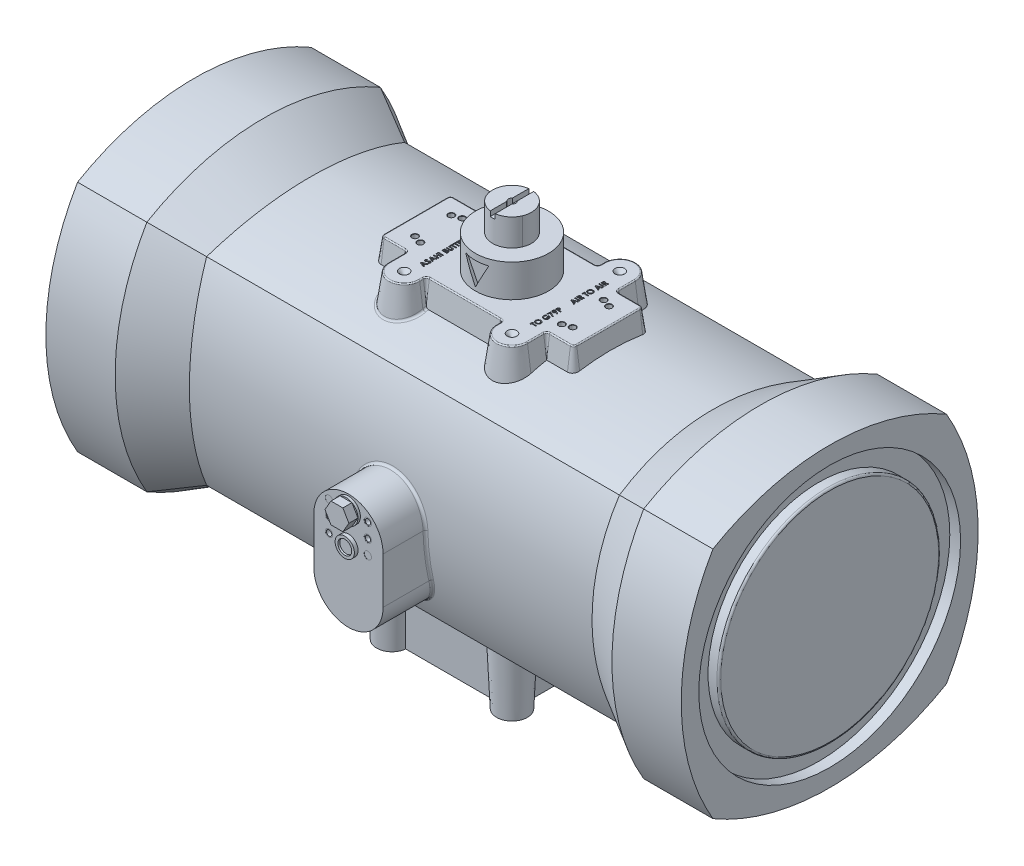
SolidWorks part; units mm, degrees
ref_plane "Front" through (0, 0, 0) normal (0, 0, 1) x (1, 0, 0)
ref_plane "Top" through (0, 0, 0) normal (0, 1, 0) x (1, 0, 0)
ref_plane "Right" through (0, 0, 0) normal (1, 0, 0) x (0, 0, -1)
sketch "Sketch1" plane through (0, 0, 0) normal (1, 0, 0) x (0, 0, -1)
  line L0 (0, 0) -> (-111.6723, 0) construction
  line L1 (0, 0) -> (0, 113.5403) construction
  circle A0 centre (0, 0) radius 72.39 construction
  circle A1 centre (0, 0) radius 100.0125 construction
  arc A2 (81.6346, 81.6346) -> (-81.6346, 81.6346) centre (0, -90.4875) ccw
  arc A3 (81.6346, -81.6346) -> (-81.6346, -81.6346) centre (0, 90.4875) cw
  arc A4 (-81.6346, 81.6346) -> (-81.6346, -81.6346) centre (90.4875, 0) ccw
  arc A5 (81.6346, 81.6346) -> (81.6346, -81.6346) centre (-90.4875, 0) cw
  dimension "D1" = 144.78
  dimension "D2" = 200.025
  dimension "D3" = 381
  dimension "D4" = 381
extrude "BODY DIA" add sketch "Sketch1" along normal mid plane 524.002
sketch "Sketch2" plane through (262.001, 0, 0) normal (1, 0, 0) x (0, 0, -1)
  line L0 (0, 0) -> (0, 112.2833) construction
  line L1 (0, 0) -> (-109.8095, 0) construction
  arc A0 (96.2969, 96.2969) -> (-96.2969, 96.2969) centre (0, -68.072) ccw
  arc A1 (96.2969, -96.2969) -> (-96.2969, -96.2969) centre (0, 68.072) cw
  arc A2 (-96.2969, 96.2969) -> (-96.2969, -96.2969) centre (68.072, 0) ccw
  arc A3 (96.2969, 96.2969) -> (96.2969, -96.2969) centre (-68.072, 0) cw
  circle A4 centre (0, 0) radius 122.428 construction
  dimension "D3" = 244.856
  dimension "D1" = 381
  dimension "D2" = 381
extrude "END1" add sketch "Sketch2" against normal blind 57.15
mirror "END2" about plane through (0, 0, 0) normal (1, 0, 0) of "END1"
sketch "Sketch3" plane through (204.851, 0, 0) normal (-1, 0, 0) x (0, 0, 1)
  arc A5 (96.2969, -96.2969) -> (96.2969, 96.2969) centre (-68.072, 0) ccw construction
  arc A6 (-96.2969, -96.2969) -> (96.2969, -96.2969) centre (0, 68.072) ccw construction
  arc A7 (-96.2969, 96.2969) -> (-96.2969, -96.2969) centre (68.072, 0) ccw construction
  arc A8 (96.2969, 96.2969) -> (-96.2969, 96.2969) centre (0, -68.072) ccw construction
  arc A9 (96.2969, -96.2969) -> (96.2969, 96.2969) centre (-68.072, 0) ccw
  arc A10 (-96.2969, -96.2969) -> (96.2969, -96.2969) centre (0, 68.072) ccw
  arc A11 (-96.2969, 96.2969) -> (-96.2969, -96.2969) centre (68.072, 0) ccw
  arc A12 (96.2969, 96.2969) -> (-96.2969, 96.2969) centre (0, -68.072) ccw
extrude "END DRAFT1" add sketch "Sketch3" along normal blind 50.8 draft 30
mirror "END DRAFT2" about plane through (0, 0, 0) normal (1, 0, 0) of "END DRAFT1"
sketch "Sketch4" plane through (262.001, 0, 0) normal (1, 0, 0) x (0, 0, -1)
  circle A0 centre (0, 0) radius 107.95
  circle A1 centre (0, 0) radius 91.44
  dimension "D1" = 16.51
  dimension "D2" = 215.9
extrude "END DIA DETAIL1" cut sketch "Sketch4" against normal blind 8.89
mirror "END DIA DETAIL2" about plane through (0, 0, 0) normal (1, 0, 0) of "END DIA DETAIL1"
ref_plane "Plane1" through (0, -147.32, 0) normal (0, 1, 0) x (-1, 0, 0)
ref_plane "Plane2" through (0, 115.57, 0) normal (0, 1, 0) x (-1, 0, 0)
sketch "Sketch5" plane through (0, -147.32, 0) normal (0, 1, 0) x (-1, 0, 0)
  line L0 (0, 0) -> (0, 75.2294) construction
  line L1 (0, 0) -> (92.8969, 0) construction
  line L2 (-49.4812, 49.4812) -> (0, 0) construction
  line L5 (50.8, 36.8499) -> (50.8, -36.8499)
  line L6 (36.8499, -50.8) -> (-36.8499, -50.8)
  line L7 (-50.8, 36.8499) -> (-50.8, -36.8499)
  line L8 (36.8499, 50.8) -> (-36.8499, 50.8)
  circle A0 centre (0, 0) radius 69.977 construction
  arc A1 (57.8778, 41.0847) -> (41.0847, 57.8778) centre (49.4812, 49.4812) ccw construction
  arc A2 (-57.8778, 41.0847) -> (-41.0847, 57.8778) centre (-49.4812, 49.4812) cw construction
  arc A3 (-57.8778, -41.0847) -> (-41.0847, -57.8778) centre (-49.4812, -49.4812) ccw construction
  arc A4 (57.8778, -41.0847) -> (41.0847, -57.8778) centre (49.4812, -49.4812) cw construction
  arc A5 (-36.8499, 50.8) -> (-50.8, 36.8499) centre (-49.4812, 49.4812) ccw
  arc A6 (50.8, 36.8499) -> (36.8499, 50.8) centre (49.4812, 49.4812) ccw
  arc A7 (36.8499, -50.8) -> (50.8, -36.8499) centre (49.4812, -49.4812) ccw
  arc A8 (-50.8, -36.8499) -> (-36.8499, -50.8) centre (-49.4812, -49.4812) ccw
  dimension "D1" = 139.954
  dimension "D4" = 23.749
  dimension "D5" = 101.6
  dimension "D6" = 101.6
  dimension "D3" = 25.4
  dimension "D2" = 45
extrude "Extrude4" add sketch "Sketch5" along normal up to next draft 2.5
sketch "Sketch6" plane through (0, -147.32, 0) normal (0, -1, 0) x (1, 0, 0)
  circle A0 centre (0, 0) radius 28.575
  circle A1 centre (0, 0) radius 28.321
  dimension "D1" = 57.15
  dimension "D2" = 0.254
extrude "Cut-Extrude2" cut sketch "Sketch6" against normal blind 19.05
sketch "Sketch7" plane through (0, -147.32, 0) normal (0, -1, 0) x (1, 0, 0)
  line L0 (0, 0) -> (0, 14.5007) construction
  line L1 (0, 0) -> (-14.398, 0) construction
  line L2 (-1.0139, 24.49) -> (-7.4699, 18.034)
  line L3 (-16.6001, 18.034) -> (-7.4699, 18.034)
  line L4 (-18.034, 16.6001) -> (-18.034, 7.4699)
  line L5 (-16.6001, -18.034) -> (-7.4699, -18.034)
  line L6 (18.034, 16.6001) -> (18.034, 7.4699)
  line L7 (-24.49, -1.0139) -> (-18.034, -7.4699)
  line L8 (1.0139, -24.49) -> (7.4699, -18.034)
  line L9 (24.49, 1.0139) -> (18.034, 7.4699)
  line L10 (0, 0) -> (-10.2431, 10.2431) construction
  line L11 (0, 0) -> (10.2285, 10.2285) construction
  line L12 (7.4699, -18.034) -> (16.6001, -18.034)
  line L13 (-7.4699, -18.034) -> (-1.0139, -24.49)
  line L14 (-18.034, -7.4699) -> (-18.034, -16.6001)
  line L15 (-18.034, 7.4699) -> (-24.49, 1.0139)
  line L16 (7.4699, 18.034) -> (16.6001, 18.034)
  line L17 (7.4699, 18.034) -> (1.0139, 24.49)
  line L18 (18.034, -7.4699) -> (18.034, -16.6001)
  line L19 (18.034, -7.4699) -> (24.49, -1.0139)
  arc A0 (-24.49, 1.0139) -> (-24.49, -1.0139) centre (0, 0) ccw
  arc A1 (-18.034, -16.6001) -> (-16.6001, -18.034) centre (0, 0) ccw
  arc A2 (-1.0139, -24.49) -> (1.0139, -24.49) centre (0, 0) ccw
  arc A3 (16.6001, -18.034) -> (18.034, -16.6001) centre (0, 0) ccw
  arc A4 (24.49, -1.0139) -> (24.49, 1.0139) centre (0, 0) ccw
  arc A5 (18.034, 16.6001) -> (16.6001, 18.034) centre (0, 0) ccw
  arc A6 (1.0139, 24.49) -> (-1.0139, 24.49) centre (0, 0) ccw
  arc A7 (-16.6001, 18.034) -> (-18.034, 16.6001) centre (0, 0) ccw
  dimension "D7" = 49.022
  dimension "D1" = 45
  dimension "D2" = 45
  dimension "D6" = 36.068
extrude "Cut-Extrude3" cut sketch "Sketch7" against normal blind 38.1
sketch "Sketch8" plane through (0, -147.32, 0) normal (0, -1, 0) x (1, 0, 0)
  line L0 (0, 0) -> (0, 59.2339) construction
  line L1 (0, 0) -> (94.2921, 0) construction
  line L2 (0, 0) -> (49.4812, 49.4812) construction
  line L3 (-49.4812, 49.4812) -> (49.4812, -49.4812) construction
  circle A0 centre (0, 0) radius 69.977 construction
  circle A1 centre (49.4812, 49.4812) radius 4.0386
  circle A2 centre (-49.4812, 49.4812) radius 4.0386
  circle A3 centre (49.4812, -49.4812) radius 4.0386
  circle A4 centre (-49.4812, -49.4812) radius 4.0386
  dimension "D2" = 139.954
  dimension "D3" = 8.0772
  dimension "D1" = 45
extrude "Cut-Extrude4" cut sketch "Sketch8" against normal blind 24.892
sketch "Sketch10" plane through (0, 115.57, 0) normal (0, 1, 0) x (-1, 0, 0)
  line L0 (0, 0) -> (0, 35.4582) construction
  line L1 (0, 0) -> (-53.975, 0) construction
  line L2 (40.005, -14.986) -> (46.3989, -21.3799) construction
  line L3 (40.005, -14.986) -> (40.005, -37.9386) construction
  line L4 (42.4207, -25.3582) -> (41.0307, -23.9682) construction
  line L5 (50.3772, -17.4017) -> (43.9833, -11.0077) construction
  line L6 (50.3772, 17.4017) -> (43.9833, 11.0077) construction
  line L7 (42.4207, 25.3582) -> (41.0307, 23.9682) construction
  line L8 (-42.4207, 25.3582) -> (-41.0307, 23.9682) construction
  line L9 (-50.3772, 17.4017) -> (-43.9833, 11.0077) construction
  line L10 (-42.4207, -25.3582) -> (-41.0307, -23.9682) construction
  line L11 (-50.3772, -17.4017) -> (-43.9833, -11.0077) construction
  line L12 (0, 0) -> (-19.9305, 19.9305) construction
  line L13 (37.398, -10.0004) -> (21.2762, -18.4304) construction
  line L14 (29.3973, -28.8991) -> (33.6634, -24.1611) construction
  line L15 (-37.398, -10.0004) -> (-21.2762, -18.4304) construction
  line L16 (-29.3973, -28.8991) -> (-33.6634, -24.1611) construction
  line L17 (37.398, 10.0004) -> (21.2762, 18.4304) construction
  line L18 (29.3973, 28.8991) -> (33.6634, 24.1611) construction
  line L19 (-37.398, 10.0004) -> (-21.2762, 18.4304) construction
  line L20 (-29.3973, 28.8991) -> (-33.6634, 24.1611) construction
  line L21 (36.4676, -50.8) -> (-36.4676, -50.8) construction
  line L22 (53.975, -44.45) -> (53.975, 44.45) construction
  line L23 (-53.975, -44.45) -> (-53.975, 44.45) construction
  line L24 (0, 0) -> (0, -71.0071) construction
  line L25 (36.4676, 50.8) -> (-36.4676, 50.8) construction
  line L26 (0, 0) -> (53.975, 0) construction
  line L27 (42.2227, -47.1336) -> (53.3801, -23.2065) construction
  line L28 (-42.2227, -47.1336) -> (-53.3801, -23.2065) construction
  line L29 (42.2227, 47.1336) -> (53.3801, 23.2065) construction
  line L30 (-42.2227, 47.1336) -> (-53.3801, 23.2065) construction
  line L31 (-53.975, -20.5229) -> (-53.975, 20.5229) construction
  line L32 (53.975, 20.5229) -> (53.975, -20.5229) construction
  line L33 (79.375, -26.035) -> (79.375, 26.035)
  line L34 (-79.375, -26.035) -> (-79.375, 26.035)
  line L35 (76.835, -28.575) -> (59.69, -28.575)
  line L36 (76.835, 28.575) -> (59.69, 28.575)
  line L37 (29.21, -38.8938) -> (-29.21, -38.8938)
  line L38 (-57.15, -44.45) -> (-57.15, -31.115)
  line L39 (44.45, -44.45) -> (44.45, 44.45) construction
  line L40 (-44.45, -44.45) -> (-44.45, 44.45) construction
  line L41 (29.21, 38.8937) -> (-29.21, 38.8938)
  line L42 (57.15, -44.45) -> (57.15, -31.115)
  line L43 (-57.15, 44.45) -> (-57.15, 31.115)
  line L44 (57.15, 44.45) -> (57.15, 31.115)
  line L48 (-59.69, 28.575) -> (-76.835, 28.575)
  line L50 (-59.69, -28.575) -> (-76.835, -28.575)
  line L51 (-31.75, -44.45) -> (-31.75, -41.4338)
  line L52 (31.75, -44.45) -> (31.75, -41.4338)
  line L53 (31.75, 44.45) -> (31.75, 41.4338)
  line L54 (-31.75, 44.45) -> (-31.75, 41.4338)
  arc A0 (42.4207, -25.3582) -> (50.3772, -17.4017) centre (46.3989, -21.3799) ccw construction
  arc A1 (43.9833, 11.0077) -> (37.398, 10.0004) centre (40.005, 14.986) cw construction
  arc A2 (43.9833, -11.0077) -> (37.398, -10.0004) centre (40.005, -14.986) ccw construction
  arc A3 (42.4207, 25.3582) -> (50.3772, 17.4017) centre (46.3989, 21.3799) cw construction
  arc A4 (-42.4207, 25.3582) -> (-50.3772, 17.4017) centre (-46.3989, 21.3799) ccw construction
  arc A5 (-43.9833, 11.0077) -> (-37.398, 10.0004) centre (-40.005, 14.986) ccw construction
  arc A6 (-43.9833, -11.0077) -> (-37.398, -10.0004) centre (-40.005, -14.986) cw construction
  arc A7 (-42.4207, -25.3582) -> (-50.3772, -17.4017) centre (-46.3989, -21.3799) cw construction
  circle A8 centre (0, 0) radius 34.5 construction
  arc A9 (-21.2762, 18.4304) -> (-29.3973, 28.8991) centre (-24.3952, 24.3952) ccw construction
  arc A10 (-21.2762, -18.4304) -> (-29.3973, -28.8991) centre (-24.3952, -24.3952) cw construction
  arc A11 (21.2762, 18.4304) -> (29.3973, 28.8991) centre (24.3952, 24.3952) cw construction
  arc A12 (21.2762, -18.4304) -> (29.3973, -28.8991) centre (24.3952, -24.3952) ccw construction
  arc A13 (33.6634, -24.1611) -> (41.0307, -23.9682) centre (37.4386, -27.5603) cw construction
  arc A14 (-41.0307, -23.9682) -> (-33.6634, -24.1611) centre (-37.4386, -27.5603) cw construction
  arc A15 (-41.0307, 23.9682) -> (-33.6634, 24.1611) centre (-37.4386, 27.5603) ccw construction
  arc A16 (41.0307, 23.9682) -> (33.6634, 24.1611) centre (37.4386, 27.5603) cw construction
  arc A17 (36.4676, -50.8) -> (42.2227, -47.1336) centre (36.4676, -44.45) ccw construction
  arc A18 (-42.2227, -47.1336) -> (-36.4676, -50.8) centre (-36.4676, -44.45) ccw construction
  arc A19 (-53.3801, 23.2065) -> (-53.975, 20.5229) centre (-47.625, 20.5229) ccw construction
  arc A20 (53.975, 20.5229) -> (53.3801, 23.2065) centre (47.625, 20.5229) ccw construction
  arc A21 (36.4676, 50.8) -> (42.2227, 47.1336) centre (36.4676, 44.45) cw construction
  arc A22 (-42.2227, 47.1336) -> (-36.4676, 50.8) centre (-36.4676, 44.45) cw construction
  arc A23 (53.3801, -23.2065) -> (53.975, -20.5229) centre (47.625, -20.5229) ccw construction
  arc A24 (-53.975, -20.5229) -> (-53.3801, -23.2065) centre (-47.625, -20.5229) ccw construction
  arc A25 (-57.15, -44.45) -> (-31.75, -44.45) centre (-44.45, -44.45) ccw
  arc A26 (57.15, -44.45) -> (31.75, -44.45) centre (44.45, -44.45) cw
  arc A27 (-57.15, 44.45) -> (-31.75, 44.45) centre (-44.45, 44.45) cw
  arc A28 (57.15, 44.45) -> (31.75, 44.45) centre (44.45, 44.45) ccw
  arc A29 (76.835, -28.575) -> (79.375, -26.035) centre (76.835, -26.035) ccw
  arc A30 (76.835, 28.575) -> (79.375, 26.035) centre (76.835, 26.035) cw
  arc A31 (-79.375, -26.035) -> (-76.835, -28.575) centre (-76.835, -26.035) ccw
  arc A32 (-76.835, 28.575) -> (-79.375, 26.035) centre (-76.835, 26.035) ccw
  arc A33 (-59.69, 28.575) -> (-57.15, 31.115) centre (-59.69, 31.115) ccw
  arc A34 (-31.75, 41.4338) -> (-29.21, 38.8938) centre (-29.21, 41.4338) ccw
  arc A35 (29.21, 38.8937) -> (31.75, 41.4338) centre (29.21, 41.4337) ccw
  arc A36 (59.69, 28.575) -> (57.15, 31.115) centre (59.69, 31.115) cw
  arc A37 (57.15, -31.115) -> (59.69, -28.575) centre (59.69, -31.115) cw
  arc A38 (29.21, -38.8938) -> (31.75, -41.4338) centre (29.21, -41.4338) cw
  arc A39 (-31.75, -41.4338) -> (-29.21, -38.8938) centre (-29.21, -41.4338) cw
  arc A40 (-59.69, -28.575) -> (-57.15, -31.115) centre (-59.69, -31.115) cw
  point P22 (37.2454, -20.1829)
  point P36 (-37.2454, -20.1829)
  point P55 (-37.2454, 20.1829)
  point P58 (37.2454, 20.1829)
  point P59 (0, 50.8)
  point P60 (0, -50.8)
  point P75 (-43.3718, 54.9152)
  point P78 (40.513, -50.8)
  point P81 (-40.513, -50.8)
  point P84 (-53.975, 21.9306)
  point P87 (53.975, 21.9306)
  point P90 (40.513, 50.8)
  point P93 (-40.513, 50.8)
  point P96 (53.975, -21.9306)
  point P99 (-53.975, -21.9306)
  point P110 (44.45, 0)
  point P134 (-57.15, 28.575)
  point P142 (57.15, 28.575)
  point P145 (57.15, -28.575)
  point P148 (31.75, -38.8938)
  point P151 (-31.75, -38.8938)
  point P154 (-57.15, -28.575)
  dimension "D1" = 40.005
  dimension "D4" = 45
  dimension "D3" = 11.2522
  dimension "D7" = 69
  dimension "D8" = 13.462
  dimension "D10" = 5.08
  dimension "D13" = 81.026
  dimension "D15" = 65
  dimension "D18" = 158.75
  dimension "D14" = 81.026
  dimension "D17" = 6.35
  dimension "D23" = 25.4
  dimension "D24" = 2.54
  dimension "D2" = 14.986
  dimension "D5" = 45
  dimension "D6" = 9.0424
  dimension "D9" = 48
  dimension "D11" = 107.95
  dimension "D12" = 50.8
  dimension "D16" = 65
  dimension "D19" = 57.15
  dimension "D20" = 77.7875
  dimension "D21" = 88.9
  dimension "D22" = 88.9
extrude "Extrude5" add sketch "Sketch10" against normal up to next draft 8
ref_plane "Plane3" through (0, 165.608, 0) normal (0, 1, 0) x (-1, 0, 0)
ref_plane "Plane4" through (0, 0, 134.874) normal (0, 0, 1) x (1, 0, 0)
ref_plane "Plane5" through (0, 0, 144.3863) normal (0, 0, 1) x (1, 0, 0)
fillet "Fillet1" radius 1.5875 2 edges at (262.001, 0, -91.44) (-262.001, 0, -91.44)
sketch "Sketch23"
  dimension "D1" = 63.5
sketch "Sketch24" plane through (0, -147.32, 0) normal (0, -1, 0) x (1, 0, 0)
  circle A0 centre (0, 0) radius 28.321 construction
  circle A1 centre (0, 0) radius 28.321
chamfer "Chamfer2" distance 0.508 angle 45 1 edges at (0, -147.32, -28.575)
ref_plane "Plane6" through (0, 136.906, 0) normal (0, 1, 0) x (-1, 0, 0)
sketch "Sketch26" plane through (0, 136.906, 0) normal (0, 1, 0) x (-1, 0, 0)
  circle A0 centre (0, 0) radius 18.2245
  dimension "D1" = 36.449
sketch "Sketch27" plane through (0, 165.608, 0) normal (0, 1, 0) x (-1, 0, 0)
  line L1 (0, 0) -> (0, -33.9544) construction
  arc A0 (-14.7755, 6.144) -> (16.002, 0) centre (0, 0) ccw
  arc A1 (16.002, 0) -> (-14.7755, 6.144) centre (0, 0) ccw
  dimension "D1" = 32.004
extrude "Extrude7" add sketch "Sketch27" against normal up to next
sketch "Sketch28" plane through (0, 165.608, 0) normal (0, 1, 0) x (1, 0, 0)
  line L0 (0, 0) -> (0, 19.8933) construction
  line L1 (-2.032, 15.8725) -> (-2.032, -15.8725)
  line L2 (2.032, 15.8725) -> (2.032, -15.8725)
  arc A0 (-16.002, 0) -> (14.7755, -6.144) centre (0, 0) ccw construction
  arc A2 (-2.032, -15.8725) -> (2.032, -15.8725) centre (0, 0) ccw
  arc A3 (2.032, 15.8725) -> (-2.032, 15.8725) centre (0, 0) ccw
  arc A4 (14.7755, -6.144) -> (-16.002, 0) centre (0, 0) ccw construction
  dimension "D1" = 4.064
extrude "Cut-Extrude15" cut sketch "Sketch28" against normal blind 4.064
extrude "ASAHI TEXT" cut sketch "Sketch23" against normal blind 0.0508
ref_plane "Plane7" through (0, 153.8732, 0) normal (0, 1, 0) x (-1, 0, 0)
sketch "Sketch29" plane through (0, 153.8732, 0) normal (0, 1, 0) x (-1, 0, 0)
  circle A0 centre (0, 0) radius 18.0975
  dimension "D1" = 36.195
sketch "Sketch33" plane through (0, 0, 134.874) normal (0, 0, 1) x (1, 0, 0)
  line L0 (0, 0) -> (0, 67.0544) construction
  line L1 (0, 0) -> (-65.5199, 0) construction
  line L2 (-22.9235, 15.4654) -> (-22.9235, -15.4654) construction
  line L3 (22.9235, 15.4654) -> (22.9235, -15.4654) construction
  line L4 (0, 23.876) -> (4.7625, 23.876) construction
  line L5 (0, -23.876) -> (4.7625, -23.876) construction
  line L6 (-1.2326, 23.7137) -> (-20.5703, 18.5322) construction
  line L7 (1.2326, 23.7137) -> (20.5703, 18.5322) construction
  line L8 (-1.2326, -23.7137) -> (-20.5703, -18.5322) construction
  line L9 (1.2326, -23.7137) -> (20.5703, -18.5322) construction
  line L10 (0, 23.876) -> (34.1115, 23.876) construction
  line L11 (0, -71.374) -> (25.6519, -71.374) construction
  line L13 (-28.575, -4.699) -> (-28.575, -42.799)
  line L14 (28.575, -4.699) -> (28.575, -42.799)
  arc A0 (1.2326, 23.7137) -> (-1.2326, 23.7137) centre (0, 19.1135) ccw construction
  arc A1 (1.2326, -23.7137) -> (-1.2326, -23.7137) centre (0, -19.1135) cw construction
  arc A2 (22.9235, 15.4654) -> (20.5703, 18.5322) centre (19.7485, 15.4654) ccw construction
  arc A3 (20.5703, -18.5322) -> (22.9235, -15.4654) centre (19.7485, -15.4654) ccw construction
  arc A4 (-22.9235, -15.4654) -> (-20.5703, -18.5322) centre (-19.7485, -15.4654) ccw construction
  arc A5 (-20.5703, 18.5322) -> (-22.9235, 15.4654) centre (-19.7485, 15.4654) ccw construction
  arc A6 (28.575, -4.699) -> (-28.575, -4.699) centre (0, -4.699) ccw
  arc A9 (-28.575, -42.799) -> (28.575, -42.799) centre (0, -42.799) ccw
  dimension "D2" = 9.525
  dimension "D5" = 3.175
  dimension "D6" = 57.15
  dimension "D7" = 28.575
  dimension "D1" = 45.847
  dimension "D3" = 47.752
  dimension "D4" = 75
  dimension "D8" = 95.25
extrude "Extrude11" add sketch "Sketch33" against normal up to next
sketch "Sketch35" plane through (0, 0, 144.3863) normal (0, 0, 1) x (1, 0, 0)
  line L0 (0, 0) -> (0, 67.4251) construction
  line L1 (0, 0) -> (-67.3734, 0) construction
  line L3 (4.92, 4.1021) -> (9.84, 12.6238)
  line L4 (9.84, 12.6238) -> (4.92, 21.1455)
  line L5 (4.92, 21.1455) -> (-4.92, 21.1455)
  line L6 (-4.92, 21.1455) -> (-9.84, 12.6238)
  line L7 (-9.84, 12.6238) -> (-4.92, 4.1021)
  line L8 (-4.92, 4.1021) -> (4.92, 4.1021)
  circle A0 centre (0, 12.6238) radius 8.5217 construction
  dimension "D1" = 17.0434
  dimension "D2" = 12.6238
extrude "Extrude12" add sketch "Sketch35" against normal up to next
sketch "Sketch36" plane through (0, 0, 134.874) normal (0, 0, 1) x (1, 0, 0)
  line L0 (4.92, 21.1455) -> (-4.92, 4.1021) construction
  circle A0 centre (0, 12.6238) radius 9.84
  point P7 (0, 12.6238)
extrude "Extrude13" add sketch "Sketch36" along normal blind 2.032
sketch "Sketch37" plane through (0, 0, 134.874) normal (0, 0, 1) x (1, 0, 0)
  line L0 (0, 0) -> (64.7785, 0) construction
  line L1 (0, 0) -> (0, 67.0544) construction
  line L2 (0, 0) -> (0, -49.343) construction
  line L3 (0, 0) -> (-65.1492, 0) construction
  circle A0 centre (0, -12.6238) radius 7.9248
  dimension "D2" = 15.8496
  dimension "D1" = 12.6238
extrude "Extrude14" add sketch "Sketch37" along normal blind 3.048
sketch "Sketch38" plane through (0, 0, 137.922) normal (0, 0, 1) x (1, 0, 0)
  circle A0 centre (0, -12.6238) radius 5.715
  dimension "D1" = 11.43
extrude "Cut-Extrude18" cut sketch "Sketch38" against normal blind 1.27 draft 15
sketch "Sketch39" plane through (0, 0, 134.874) normal (0, 0, 1) x (1, 0, 0)
  line L0 (0, 0) -> (0, 67.0544) construction
  line L1 (0, 0) -> (0, -51.0112) construction
  line L2 (0, 0) -> (-64.5932, 0) construction
  line L3 (0, 0) -> (65.7052, 0) construction
  line L4 (-16.002, 11.9888) -> (-16.002, -11.9888) construction
  line L5 (16.002, 11.9888) -> (16.002, -11.9888) construction
  circle A0 centre (-16.002, 0) radius 3.0226
  circle A1 centre (-16.002, 11.9888) radius 3.0226
  circle A2 centre (-16.002, -11.9888) radius 3.0226
  circle A3 centre (16.002, 11.9888) radius 3.0226
  circle A4 centre (16.002, 0) radius 3.0226
  circle A5 centre (16.002, -11.9888) radius 3.0226
  dimension "D3" = 6.0452
  dimension "D1" = 32.004
  dimension "D2" = 23.9776
extrude "Cut-Extrude19" cut sketch "Sketch39" against normal blind 0.0508
sketch "Sketch40" plane through (0, 0, 134.874) normal (0, 0, 1) x (1, 0, 0)
  circle A0 centre (-16.002, 0) radius 2.1971
  circle A1 centre (-16.002, -11.9888) radius 2.1971
  circle A2 centre (16.002, 0) radius 2.1971
  circle A3 centre (16.002, 11.9888) radius 2.1971
  dimension "D1" = 4.3942
extrude "Cut-Extrude20" cut sketch "Sketch40" against normal blind 8
fillet "Fillet6" radius 1 34 edges at (-3.1326, 115.57, 15.6924) (3.1326, 115.57, -15.6924) (-31.75, 115.57, -42.9419) (0, 115.57, -38.8938) (31.75, 115.57, -42.9419) (44.45, 115.57, -57.15) (57.15, 115.57, -37.7825) (68.2625, 115.57, -28.575) (79.375, 115.57, 0) (68.2625, 115.57, 28.575) (57.15, 115.57, 37.7825) (44.45, 115.57, 57.15) (31.75, 115.57, 42.9419) (0, 115.57, 38.8938) (-31.75, 115.57, 42.9419) (-44.45, 115.57, 57.15) (-57.15, 115.57, 37.7825) (-68.2625, 115.57, 28.575) (-79.375, 115.57, 0) (-68.2625, 115.57, -28.575) (-57.15, 115.57, -37.7825) (-44.45, 115.57, -57.15) (-31.0061, 115.57, -39.6377) (31.0061, 115.57, -39.6377) (57.8939, 115.57, -29.3189) (78.6311, 115.57, -27.8311) (78.6311, 115.57, 27.8311) (57.8939, 115.57, 29.3189) (31.0061, 115.57, 39.6377) (-31.0061, 115.57, 39.6377) (-57.8939, 115.57, 29.3189) (-78.6311, 115.57, 27.8311) (-78.6311, 115.57, -27.8311) (-57.8939, 115.57, -29.3189)
sketch "Sketch42" plane through (0, 115.57, 0) normal (0, 1, 0) x (1, 0, 0)
  line L0 (0, 0) -> (0, 73.8772) construction
  line L1 (0, 0) -> (-149.1515, 0) construction
  circle A0 centre (-44.45, 44.45) radius 3.9687
  circle A1 centre (44.45, 44.45) radius 3.9687
  circle A2 centre (44.45, -44.45) radius 3.9687
  circle A3 centre (-44.45, -44.45) radius 3.9687
  arc A4 (-32.6193, 44.45) -> (-56.2807, 44.45) centre (-44.45, 44.45) ccw construction
  dimension "D1" = 7.9375
extrude "Cut-Extrude21" cut sketch "Sketch42" against normal blind 10 draft 45
sketch "Sketch43" plane through (0, 115.57, 0) normal (0, 1, 0) x (1, 0, 0)
  line L0 (0, 0) -> (0, 73.8772) construction
  line L1 (0, 0) -> (-147.7394, 0) construction
  circle A0 centre (-58.3406, 17.272) radius 2.3812
  circle A1 centre (-65.024, 14.986) radius 2.3813
  circle A2 centre (-65.024, -14.986) radius 2.3813
  circle A3 centre (65.024, 14.986) radius 2.3813
  circle A4 centre (65.024, -14.986) radius 2.3813
  circle A5 centre (-58.3406, -17.272) radius 2.3812
  circle A6 centre (58.3406, 17.272) radius 2.3812
  circle A7 centre (58.3406, -17.272) radius 2.3812
  dimension "D1" = 116.6813
  dimension "D5" = 4.7625
  dimension "D2" = 34.544
  dimension "D3" = 130.048
  dimension "D4" = 29.972
extrude "Cut-Extrude22" cut sketch "Sketch43" against normal blind 6
chamfer "Chamfer3" distance 0.254 angle 45 8 edges at (65.024, 115.57, 17.3673) (65.024, 115.57, -12.6047) (58.3406, 115.57, -14.8907) (58.3406, 115.57, 19.6533) (-65.024, 115.57, 17.3673) (-58.3406, 115.57, 19.6533) (-58.3406, 115.57, -14.8907) (-65.024, 115.57, -12.6047)
sketch "Sketch44"
  dimension "D1" = 63.5
extrude "TEXT2" cut sketch "Sketch44" against normal blind 0.0508
sketch "Sketch45" plane through (0, 165.608, 0) normal (0, 1, 0) x (1, 0, 0)
  circle A0 centre (0, 0) radius 3.0861
  dimension "D1" = 6.1722
extrude "Cut-Extrude23" cut sketch "Sketch45" against normal blind 11.938
ref_plane "Plane8" through (0, 143.383, 0) normal (0, 1, 0) x (-1, 0, 0)
sketch "Sketch46" plane through (0, 143.383, 0) normal (0, 1, 0) x (-1, 0, 0)
  circle A0 centre (0, 0) radius 30.1625
  dimension "D1" = 60.325
extrude "Extrude15" add sketch "Sketch46" against normal blind 26.924
ref_plane "Plane10" through (0, 0, 30.1625) normal (0, 0, 1) x (1, 0, 0)
sketch "Sketch47" plane through (0, 0, 30.1625) normal (0, 0, 1) x (1, 0, 0)
  line L0 (0, 0) -> (0, 158.8154) construction
  line L1 (-9.525, 138.303) -> (9.525, 138.303)
  line L2 (14.7755, 143.383) -> (-16.002, 143.383) construction
  line L3 (-9.525, 138.303) -> (0, 119.253)
  line L4 (9.525, 138.303) -> (0, 119.253)
  point P5 (0, 138.303)
  dimension "D1" = 19.05
  dimension "D2" = 5.08
  dimension "D3" = 19.05
extrude "Cut-Extrude24" cut sketch "Sketch47" against normal blind 2.54
fillet "Fillet8" radius 2 15 edges at (-59.8691, 96.2226, 37.8097) (-28.8696, 95.0748, 43.0914) (-42.5597, 90.1107, 60.6179) (28.575, -23.8706, 98.511) (4.189, -71.0653, 86.2608) (-28.575, -23.8706, 98.511) (-3.1111, 23.7061, 98.5317) (58.8847, -89.8341, 61.4359) (-39.2867, -96.0685, 38.5631) (0, -92.4343, 53.1964) (52.8655, -100.0125, 0) (37.4663, -95.6414, -40.5742) (0, -92.4343, -53.1964) (-52.8655, -100.0125, 0) (-40.89, -96.3301, -37.2753)
sketch "Sketch48"
extrude "Cut-Extrude25" cut sketch "Sketch48" against normal blind 2.54
